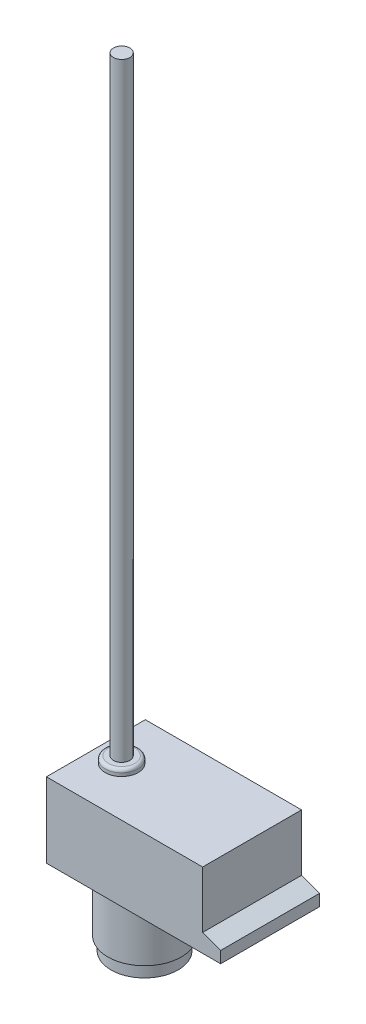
SolidWorks part; units mm, degrees
ref_plane "Front Plane" through (0, 0, 0) normal (0, 0, 1) x (1, 0, 0)
ref_plane "Top Plane" through (0, 0, 0) normal (0, 1, 0) x (1, 0, 0)
ref_plane "Right Plane" through (0, 0, 0) normal (1, 0, 0) x (0, 0, -1)
sketch "Sketch1" plane through (0, 0, 0) normal (0, 0, 1) x (1, 0, 0)
  line L0 (-34.35, 0) -> (34.35, 0)
  line L1 (34.35, 0) -> (34.35, 4.572)
  line L2 (-34.35, 0) -> (-34.35, 29.5)
  line L3 (34.35, 4.572) -> (27.238, 7.148)
  line L4 (27.238, 7.148) -> (27.238, 29.5)
  line L5 (27.238, 29.5) -> (-34.35, 29.5)
  dimension "D1" = 29.5
  dimension "D2" = 68.7
  dimension "D3" = 4.572
  dimension "D4" = 7.112
  dimension "D5" = 22.352
extrude "Boss-Extrude1" add sketch "Sketch1" along normal mid plane 39
ref_plane "Plane1" through (-15.15, 0, 0) normal (1, 0, 0) x (0, 0, -1)
sketch "Sketch3" plane through (-15.15, 0, 0) normal (1, 0, 0) x (0, 0, -1)
  line L0 (0, 29.5) -> (0, -40.4579) construction
  line L1 (-19.5, 29.5) -> (19.5, 29.5) construction
  line L2 (0, 0) -> (-14.5, 0)
  line L3 (-19.5, 0) -> (19.5, 0) construction
  line L4 (-14.5, 0) -> (-14.5, -24.92)
  line L5 (-14.5, -24.92) -> (-13.23, -24.92)
  line L6 (-13.23, -24.92) -> (-13.23, -30)
  line L8 (-13.23, -30) -> (0, -30)
  line L9 (0, -30) -> (0, 0)
  dimension "D1" = 59.5
  dimension "D2" = 29
  dimension "D3" = 5.08
  dimension "D4" = 1.27
revolve "Revolve2" add sketch "Sketch3" angle 360 about L0
sketch "Sketch4" plane through (0, 29.5, 0) normal (0, 1, 0) x (1, 0, 0)
  line L0 (-34.35, 0) -> (-24.19, 0) construction
  line L1 (-34.35, -19.5) -> (-34.35, 19.5) construction
  circle A0 centre (-24.19, 0) radius 6.5
  dimension "D1" = 13
  dimension "D2" = 10.16
extrude "Boss-Extrude2" add sketch "Sketch4" along normal blind 2.54
fillet "Fillet1" radius 1.27 1 edges at (-30.69, 32.04, 0)
sketch "Sketch6" plane through (0, 32.04, 0) normal (0, 1, 0) x (1, 0, 0)
  circle A0 centre (-24.19, 0) radius 3.25
  circle A1 centre (-24.19, 0) radius 5.23 construction
  dimension "D1" = 6.5
extrude "Boss-Extrude3" add sketch "Sketch6" along normal blind 240
hole_wizard "M4x0.7 Tapped Hole1" positions "Sketch8" profile "Sketch7" tap size "M4x0.7" standard "ANSI Metric"
sketch "Sketch8" plane through (0, 0, 0) normal (0, -1, 0) x (-1, 0, 0)
  line L0 (-4.85, 10) -> (-4.85, -10) construction
  line L1 (34.35, 19.5) -> (-34.35, 19.5) construction
  line L2 (-34.35, -19.5) -> (-34.35, 19.5) construction
  point P0 (-4.85, -10)
  point P2 (-4.85, 10)
  dimension "D1" = 20
  dimension "D2" = 9.5
  dimension "D3" = 29.5
sketch "Sketch7" plane through (4.85, 0, 10) normal (1, 0, 0) x (0, 0, -1)
  line L0 (0, 0) -> (0, 6.9914)
  line L1 (0, 6.9914) -> (1.65, 6)
  line L2 (1.65, 6) -> (1.65, 0)
  line L5 (1.65, 0) -> (0, 0)
  line L10 (0, 6.9914) -> (-1.65, 6) construction
  line L11 (0, -6.35) -> (0, 107.95) construction
  dimension "Tap Drill Dia." = 3.3
  dimension "Tap Drill Depth" = 6
  dimension "Drill Angle" = 118
